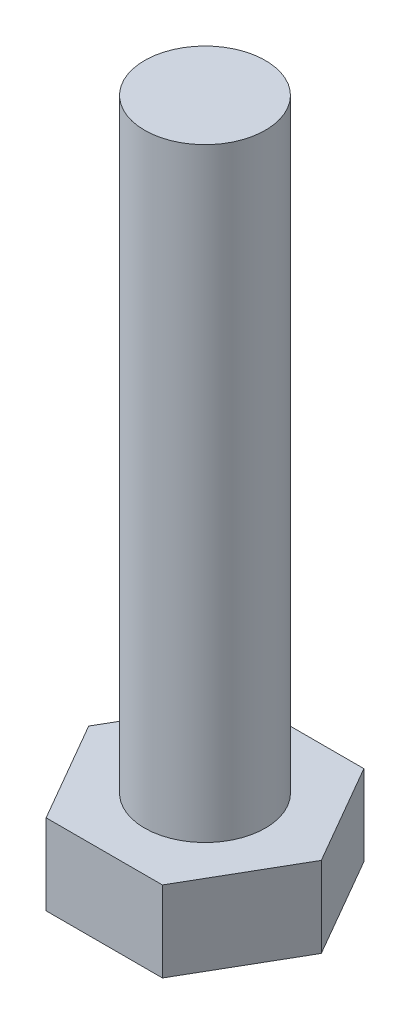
SolidWorks part; units mm, degrees
ref_plane "Plan de face" through (0, 0, 0) normal (0, 0, 1) x (1, 0, 0)
ref_plane "Plan de dessus" through (0, 0, 0) normal (0, 1, 0) x (1, 0, 0)
ref_plane "Plan de droite" through (0, 0, 0) normal (1, 0, 0) x (0, 0, -1)
sketch "Esquisse1" plane through (0, 0, 0) normal (0, 1, 0) x (1, 0, 0)
  line L1 (5.7735, 0) -> (2.8868, 5)
  line L2 (2.8868, 5) -> (-2.8868, 5)
  line L3 (-2.8868, 5) -> (-5.7735, 0)
  line L4 (-5.7735, 0) -> (-2.8868, -5)
  line L5 (-2.8868, -5) -> (2.8868, -5)
  line L6 (2.8868, -5) -> (5.7735, 0)
  circle A0 centre (0, 0) radius 5 construction
  dimension "D1" = 10
extrude "Extrusion1" add sketch "Esquisse1" along normal blind 4
sketch "Esquisse2" plane through (0, 4, 0) normal (0, 1, 0) x (-1, 0, 0)
  circle A0 centre (0, 0) radius 3
  dimension "D1" = 6
extrude "Extrusion2" add sketch "Esquisse2" along normal blind 30
